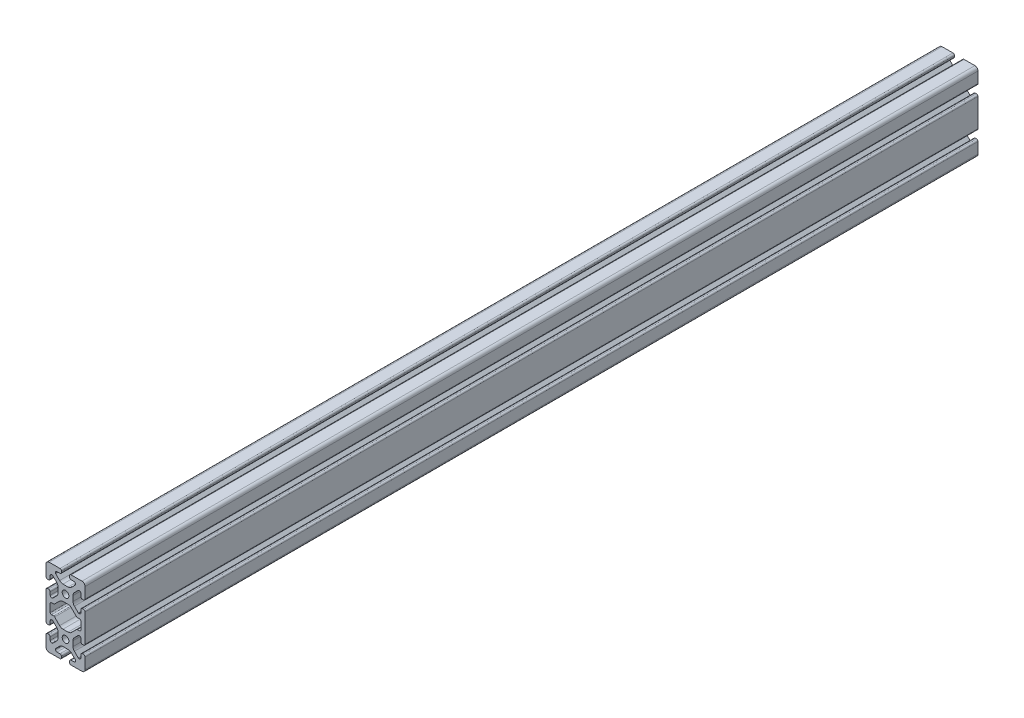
SolidWorks part; units mm, degrees
ref_plane "Front Plane" through (0, 0, 0) normal (0, 0, 1) x (1, 0, 0)
ref_plane "Top Plane" through (0, 0, 0) normal (0, 1, 0) x (1, 0, 0)
ref_plane "Right Plane" through (0, 0, 0) normal (1, 0, 0) x (0, 0, -1)
ref_plane "Plane1" through (0, 0, -3048) normal (0, 0, -1) x (-1, 0, 0)
sketch "Sketch1" plane through (0, 0, -3048) normal (0, 0, -1) x (-1, 0, 0)
  line L0 (14.41, 14.6586) -> (12.13, 14.6586)
  line L1 (11.1794, 14.2308) -> (6.0551, 9.1098)
  line L2 (2.6153, 7.685) -> (-2.6153, 7.685)
  line L3 (-6.0551, 9.1098) -> (-11.232, 14.2867)
  line L4 (-12.13, 14.6586) -> (-14.41, 14.6586)
  line L5 (-15.68, 15.9286) -> (-15.68, 24.0714)
  line L6 (-14.41, 25.3414) -> (-12.13, 25.3414)
  line L7 (-11.232, 25.7133) -> (-6.0551, 30.8902)
  line L8 (-2.6153, 32.315) -> (2.6176, 32.315)
  line L9 (6.0573, 30.8902) -> (11.1842, 25.7634)
  line L10 (12.13, 25.3414) -> (14.41, 25.3414)
  line L11 (15.68, 24.0714) -> (15.68, 15.9286)
  line L12 (16.83, 60) -> (5.6904, 60)
  line L13 (4.1204, 58.43) -> (4.1204, 57.25)
  line L14 (5.6904, 55.68) -> (8.7154, 55.68)
  line L15 (10.2854, 54.11) -> (10.2854, 53.6549)
  line L16 (10.0628, 53.1175) -> (6.0551, 49.1098)
  line L17 (2.6153, 47.685) -> (-2.6153, 47.685)
  line L18 (-6.0551, 49.1098) -> (-10.0628, 53.1175)
  line L19 (-10.2854, 53.6549) -> (-10.2854, 54.11)
  line L20 (-8.7154, 55.68) -> (-5.6904, 55.68)
  line L21 (-4.1204, 57.25) -> (-4.1204, 58.43)
  line L22 (-5.6904, 60) -> (-16.83, 60)
  line L23 (-20, 56.83) -> (-20, 45.6904)
  line L24 (-18.43, 44.1204) -> (-17.25, 44.1204)
  line L25 (-15.68, 45.6904) -> (-15.68, 48.7154)
  line L26 (-14.11, 50.2854) -> (-13.6527, 50.2854)
  line L27 (-13.1153, 50.0628) -> (-9.1098, 46.0573)
  line L28 (-7.685, 42.6176) -> (-7.685, 37.3847)
  line L29 (-9.1098, 33.9449) -> (-13.1175, 29.9372)
  line L30 (-13.6549, 29.7146) -> (-14.11, 29.7146)
  line L31 (-15.68, 31.2846) -> (-15.68, 34.3096)
  line L32 (-17.25, 35.8796) -> (-18.43, 35.8796)
  line L33 (-20, 34.3096) -> (-20, 5.6904)
  line L34 (-18.43, 4.1204) -> (-17.25, 4.1204)
  line L35 (-15.68, 5.6904) -> (-15.68, 8.7154)
  line L36 (-14.11, 10.2854) -> (-13.6549, 10.2854)
  line L37 (-13.1175, 10.0628) -> (-9.1098, 6.0551)
  line L38 (-7.685, 2.6153) -> (-7.685, -2.6153)
  line L39 (-9.1098, -6.0551) -> (-13.1175, -10.0628)
  line L40 (-13.6549, -10.2854) -> (-14.11, -10.2854)
  line L41 (-15.68, -8.7154) -> (-15.68, -5.6904)
  line L42 (-17.25, -4.1204) -> (-18.43, -4.1204)
  line L43 (-20, -5.6904) -> (-20, -16.83)
  line L44 (-16.83, -20) -> (-5.6904, -20)
  line L45 (-4.1204, -18.43) -> (-4.1204, -17.25)
  line L46 (-5.6904, -15.68) -> (-8.7154, -15.68)
  line L47 (-10.2854, -14.11) -> (-10.2854, -13.6549)
  line L48 (-10.0628, -13.1175) -> (-6.0551, -9.1098)
  line L49 (-2.6153, -7.685) -> (2.6153, -7.685)
  line L50 (6.0551, -9.1098) -> (10.0628, -13.1175)
  line L51 (10.2854, -13.6549) -> (10.2854, -14.11)
  line L52 (8.7154, -15.68) -> (5.6904, -15.68)
  line L53 (4.1204, -17.25) -> (4.1204, -18.43)
  line L54 (5.6904, -20) -> (16.83, -20)
  line L55 (20, -16.83) -> (20, -5.6904)
  line L56 (18.43, -4.1204) -> (17.25, -4.1204)
  line L57 (15.68, -5.6904) -> (15.68, -8.7154)
  line L58 (14.11, -10.2854) -> (13.6549, -10.2854)
  line L59 (13.1175, -10.0628) -> (9.1098, -6.0551)
  line L60 (7.685, -2.6153) -> (7.685, 2.6153)
  line L61 (9.1098, 6.0551) -> (13.1175, 10.0628)
  line L62 (13.6549, 10.2854) -> (14.11, 10.2854)
  line L63 (15.68, 8.7154) -> (15.68, 5.6904)
  line L64 (17.25, 4.1204) -> (18.43, 4.1204)
  line L65 (20, 5.6904) -> (20, 34.3096)
  line L66 (18.43, 35.8796) -> (17.25, 35.8796)
  line L67 (15.68, 34.3096) -> (15.68, 31.2846)
  line L68 (14.11, 29.7146) -> (13.6549, 29.7146)
  line L69 (13.1175, 29.9372) -> (9.1098, 33.9449)
  line L70 (7.685, 37.3847) -> (7.685, 42.6153)
  line L71 (9.1098, 46.0551) -> (13.1175, 50.0628)
  line L72 (13.6549, 50.2854) -> (14.11, 50.2854)
  line L73 (15.68, 48.7154) -> (15.68, 45.6904)
  line L74 (17.25, 44.1204) -> (18.43, 44.1204)
  line L75 (20, 45.6904) -> (20, 56.83)
  arc A0 (15.68, 15.9286) -> (14.41, 14.6586) centre (14.41, 15.9286) cw
  arc A1 (12.13, 14.6586) -> (11.1794, 14.2308) centre (12.13, 13.3886) ccw
  arc A2 (6.0551, 9.1098) -> (2.6153, 7.685) centre (2.6153, 12.5496) cw
  arc A3 (-2.6153, 7.685) -> (-6.0551, 9.1098) centre (-2.6153, 12.5496) cw
  arc A4 (-11.232, 14.2867) -> (-12.13, 14.6586) centre (-12.13, 13.3886) ccw
  arc A5 (-14.41, 14.6586) -> (-15.68, 15.9286) centre (-14.41, 15.9286) cw
  arc A6 (-15.68, 24.0714) -> (-14.41, 25.3414) centre (-14.41, 24.0714) cw
  arc A7 (-12.13, 25.3414) -> (-11.232, 25.7133) centre (-12.13, 26.6114) ccw
  arc A8 (-6.0551, 30.8902) -> (-2.6153, 32.315) centre (-2.6153, 27.4504) cw
  arc A9 (2.6176, 32.315) -> (6.0573, 30.8902) centre (2.6176, 27.4504) cw
  arc A10 (11.1842, 25.7634) -> (12.13, 25.3414) centre (12.13, 26.6123) ccw
  arc A11 (14.41, 25.3414) -> (15.68, 24.0714) centre (14.41, 24.0714) cw
  circle A12 centre (0, 0) radius 3.405
  circle A13 centre (0, 40) radius 3.405
  arc A14 (5.6904, 60) -> (4.1204, 58.43) centre (5.6904, 58.43) ccw
  arc A15 (4.1204, 57.25) -> (5.6904, 55.68) centre (5.6904, 57.25) ccw
  arc A16 (8.7154, 55.68) -> (10.2854, 54.11) centre (8.7154, 54.11) cw
  arc A17 (10.2854, 53.6549) -> (10.0628, 53.1175) centre (9.5254, 53.6549) cw
  arc A18 (6.0551, 49.1098) -> (2.6153, 47.685) centre (2.6153, 52.5496) cw
  arc A19 (-2.6153, 47.685) -> (-6.0551, 49.1098) centre (-2.6153, 52.5496) cw
  arc A20 (-10.0628, 53.1175) -> (-10.2854, 53.6549) centre (-9.5254, 53.6549) cw
  arc A21 (-10.2854, 54.11) -> (-8.7154, 55.68) centre (-8.7154, 54.11) cw
  arc A22 (-5.6904, 55.68) -> (-4.1204, 57.25) centre (-5.6904, 57.25) ccw
  arc A23 (-4.1204, 58.43) -> (-5.6904, 60) centre (-5.6904, 58.43) ccw
  arc A24 (-16.83, 60) -> (-20, 56.83) centre (-16.83, 56.83) ccw
  arc A25 (-20, 45.6904) -> (-18.43, 44.1204) centre (-18.43, 45.6904) ccw
  arc A26 (-17.25, 44.1204) -> (-15.68, 45.6904) centre (-17.25, 45.6904) ccw
  arc A27 (-15.68, 48.7154) -> (-14.11, 50.2854) centre (-14.11, 48.7154) cw
  arc A28 (-13.6527, 50.2854) -> (-13.1153, 50.0628) centre (-13.6527, 49.5254) cw
  arc A29 (-9.1098, 46.0573) -> (-7.685, 42.6176) centre (-12.5496, 42.6176) cw
  arc A30 (-7.685, 37.3847) -> (-9.1098, 33.9449) centre (-12.5496, 37.3847) cw
  arc A31 (-13.1175, 29.9372) -> (-13.6549, 29.7146) centre (-13.6549, 30.4746) cw
  arc A32 (-14.11, 29.7146) -> (-15.68, 31.2846) centre (-14.11, 31.2846) cw
  arc A33 (-15.68, 34.3096) -> (-17.25, 35.8796) centre (-17.25, 34.3096) ccw
  arc A34 (-18.43, 35.8796) -> (-20, 34.3096) centre (-18.43, 34.3096) ccw
  arc A35 (-20, 5.6904) -> (-18.43, 4.1204) centre (-18.43, 5.6904) ccw
  arc A36 (-17.25, 4.1204) -> (-15.68, 5.6904) centre (-17.25, 5.6904) ccw
  arc A37 (-15.68, 8.7154) -> (-14.11, 10.2854) centre (-14.11, 8.7154) cw
  arc A38 (-13.6549, 10.2854) -> (-13.1175, 10.0628) centre (-13.6549, 9.5254) cw
  arc A39 (-9.1098, 6.0551) -> (-7.685, 2.6153) centre (-12.5496, 2.6153) cw
  arc A40 (-7.685, -2.6153) -> (-9.1098, -6.0551) centre (-12.5496, -2.6153) cw
  arc A41 (-13.1175, -10.0628) -> (-13.6549, -10.2854) centre (-13.6549, -9.5254) cw
  arc A42 (-14.11, -10.2854) -> (-15.68, -8.7154) centre (-14.11, -8.7154) cw
  arc A43 (-15.68, -5.6904) -> (-17.25, -4.1204) centre (-17.25, -5.6904) ccw
  arc A44 (-18.43, -4.1204) -> (-20, -5.6904) centre (-18.43, -5.6904) ccw
  arc A45 (-20, -16.83) -> (-16.83, -20) centre (-16.83, -16.83) ccw
  arc A46 (-5.6904, -20) -> (-4.1204, -18.43) centre (-5.6904, -18.43) ccw
  arc A47 (-4.1204, -17.25) -> (-5.6904, -15.68) centre (-5.6904, -17.25) ccw
  arc A48 (-8.7154, -15.68) -> (-10.2854, -14.11) centre (-8.7154, -14.11) cw
  arc A49 (-10.2854, -13.6549) -> (-10.0628, -13.1175) centre (-9.5254, -13.6549) cw
  arc A50 (-6.0551, -9.1098) -> (-2.6153, -7.685) centre (-2.6153, -12.5496) cw
  arc A51 (2.6153, -7.685) -> (6.0551, -9.1098) centre (2.6153, -12.5496) cw
  arc A52 (10.0628, -13.1175) -> (10.2854, -13.6549) centre (9.5254, -13.6549) cw
  arc A53 (10.2854, -14.11) -> (8.7154, -15.68) centre (8.7154, -14.11) cw
  arc A54 (5.6904, -15.68) -> (4.1204, -17.25) centre (5.6904, -17.25) ccw
  arc A55 (4.1204, -18.43) -> (5.6904, -20) centre (5.6904, -18.43) ccw
  arc A56 (16.83, -20) -> (20, -16.83) centre (16.83, -16.83) ccw
  arc A57 (20, -5.6904) -> (18.43, -4.1204) centre (18.43, -5.6904) ccw
  arc A58 (17.25, -4.1204) -> (15.68, -5.6904) centre (17.25, -5.6904) ccw
  arc A59 (15.68, -8.7154) -> (14.11, -10.2854) centre (14.11, -8.7154) cw
  arc A60 (13.6549, -10.2854) -> (13.1175, -10.0628) centre (13.6549, -9.5254) cw
  arc A61 (9.1098, -6.0551) -> (7.685, -2.6153) centre (12.5496, -2.6153) cw
  arc A62 (7.685, 2.6153) -> (9.1098, 6.0551) centre (12.5496, 2.6153) cw
  arc A63 (13.1175, 10.0628) -> (13.6549, 10.2854) centre (13.6549, 9.5254) cw
  arc A64 (14.11, 10.2854) -> (15.68, 8.7154) centre (14.11, 8.7154) cw
  arc A65 (15.68, 5.6904) -> (17.25, 4.1204) centre (17.25, 5.6904) ccw
  arc A66 (18.43, 4.1204) -> (20, 5.6904) centre (18.43, 5.6904) ccw
  arc A67 (20, 34.3096) -> (18.43, 35.8796) centre (18.43, 34.3096) ccw
  arc A68 (17.25, 35.8796) -> (15.68, 34.3096) centre (17.25, 34.3096) ccw
  arc A69 (15.68, 31.2846) -> (14.11, 29.7146) centre (14.11, 31.2846) cw
  arc A70 (13.6549, 29.7146) -> (13.1175, 29.9372) centre (13.6549, 30.4746) cw
  arc A71 (9.1098, 33.9449) -> (7.685, 37.3847) centre (12.5496, 37.3847) cw
  arc A72 (7.685, 42.6153) -> (9.1098, 46.0551) centre (12.5496, 42.6153) cw
  arc A73 (13.1175, 50.0628) -> (13.6549, 50.2854) centre (13.6549, 49.5254) cw
  arc A74 (14.11, 50.2854) -> (15.68, 48.7154) centre (14.11, 48.7154) cw
  arc A75 (15.68, 45.6904) -> (17.25, 44.1204) centre (17.25, 45.6904) ccw
  arc A76 (18.43, 44.1204) -> (20, 45.6904) centre (18.43, 45.6904) ccw
  arc A77 (20, 56.83) -> (16.83, 60) centre (16.83, 56.83) ccw
extrude "Boss-Extrude1" add sketch "Sketch1" against normal blind 3048
ref_plane "Plane2" through (0, 0, -914.4) normal (0, 0, 1) x (1, 0, 0)
ref_plane "Plane3" through (0, 0, -1828.8) normal (0, 0, 1) x (1, 0, 0)
ref_plane "Plane4" through (0, 0, -2133.6) normal (0, 0, 1) x (1, 0, 0)
ref_plane "Plane5" through (0, 0, -2438.4) normal (0, 0, 1) x (1, 0, 0)
sketch "Sketch26" plane through (0, 0, -914.4) normal (0, 0, 1) x (1, 0, 0)
  line L0 (-20, -20.8001) -> (20, -20.8001)
  line L1 (-20, -20.8001) -> (-20, 60)
  line L2 (-20, 60) -> (20, 60)
  line L3 (20, -20.8001) -> (20, 60)
sketch "Sketch33" plane through (0, 0, -1828.8) normal (0, 0, 1) x (1, 0, 0)
  line L0 (-20, -20.8001) -> (20, -20.8001)
  line L1 (-20, -20.8001) -> (-20, 60)
  line L2 (-20, 60) -> (20, 60)
  line L3 (20, -20.8001) -> (20, 60)
sketch "Sketch41" plane through (0, 0, -2133.6) normal (0, 0, 1) x (1, 0, 0)
  line L0 (-20, -20.8001) -> (20, -20.8001)
  line L1 (-20, -20.8001) -> (-20, 60)
  line L2 (-20, 60) -> (20, 60)
  line L3 (20, -20.8001) -> (20, 60)
sketch "Sketch50" plane through (0, 0, -2438.4) normal (0, 0, 1) x (1, 0, 0)
  line L0 (-20, -20.8001) -> (20, -20.8001)
  line L1 (-20, -20.8001) -> (-20, 60)
  line L2 (-20, 60) -> (20, 60)
  line L3 (20, -20.8001) -> (20, 60)
extrude "Cut 1 - 3ft" cut sketch "Sketch26" along normal through all
extrude "Cut 2 - 3ft" cut sketch "Sketch33" against normal through all
